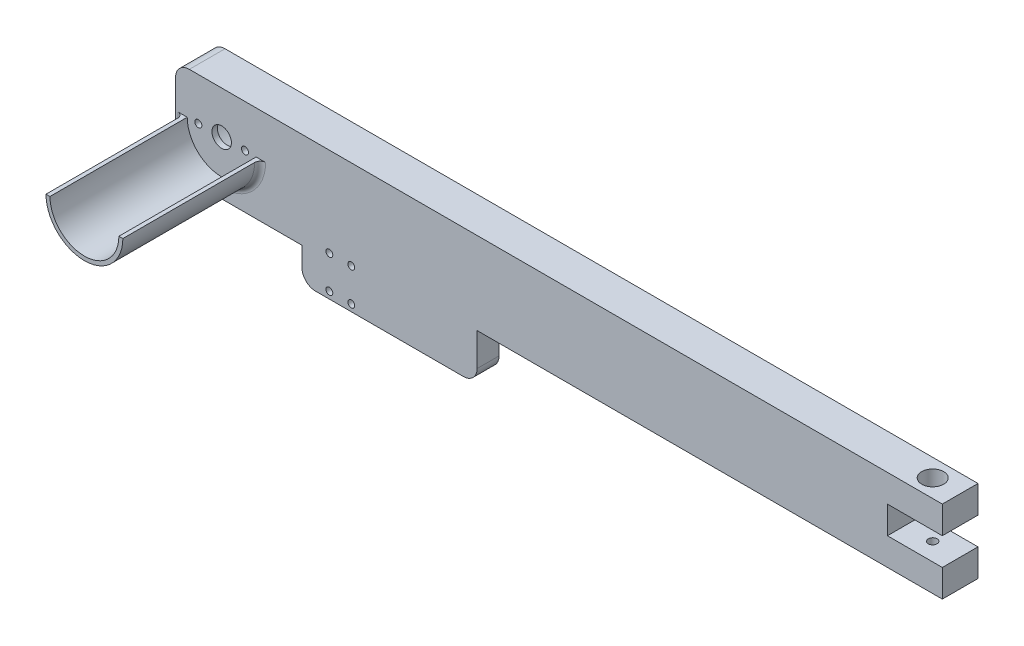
SolidWorks part; units mm, degrees
ref_plane "Front Plane" through (0, 0, 0) normal (0, 0, 1) x (1, 0, 0)
ref_plane "Top Plane" through (0, 0, 0) normal (0, 1, 0) x (1, 0, 0)
ref_plane "Right Plane" through (0, 0, 0) normal (1, 0, 0) x (0, 0, -1)
sketch "Sketch1" plane through (0, 0, 0) normal (0, 0, 1) x (1, 0, 0)
  line L1 (0, 0) -> (355.325, 0)
  line L2 (0, 0) -> (0, 30)
  line L3 (0, 30) -> (355.325, 30)
  line L4 (355.325, 0) -> (355.325, 30)
  line L5 (50, 0) -> (250, 0)
  line L6 (50, 0) -> (50, -17)
  line L7 (50, -17) -> (250, -17)
  line L8 (250, 0) -> (250, -17)
  line L9 (0, 0) -> (355.325, 0)
  line L10 (0, 0) -> (0, -17)
  line L11 (0, -17) -> (355.325, -17)
  line L12 (355.325, 0) -> (355.325, -17)
  line L13 (0, 0) -> (177.6625, 0)
  line L14 (0, 0) -> (0, -17)
  line L15 (0, -17) -> (177.6625, -17)
  line L16 (177.6625, 0) -> (177.6625, -17)
  line L17 (0, 0) -> (50, 0)
  line L18 (0, 0) -> (0, -5)
  line L19 (0, -5) -> (50, -5)
  line L20 (50, 0) -> (50, -5)
  circle A0 centre (20.775, 14.5) radius 12.5
  circle A1 centre (334.55, 14.5) radius 12.5
  circle A2 centre (60, -2.5) radius 1
  circle A3 centre (68, -2.5) radius 1
  circle A4 centre (60, -14.5) radius 1
  circle A5 centre (68, -14.5) radius 1
  dimension "D1" = 25
  dimension "D11" = 2
  dimension "D2" = 313.775
  dimension "D3" = 20.775
  dimension "D4" = 20.775
  dimension "D5" = 30
  dimension "D6" = 15.5
  dimension "D7" = 15.5
  dimension "D8" = 17
  dimension "D9" = 50
  dimension "D10" = 200
  dimension "D12" = 8
  dimension "D13" = 12
  dimension "D14" = 8
  dimension "D15" = 12
  dimension "D16" = 10
  dimension "D17" = 10
  dimension "D18" = 2.5
  dimension "D19" = 2.5
  dimension "D20" = 5
extrude "Boss-Extrude3" add sketch "Sketch1" along normal blind 13 contours L1 L9 L4 L3 L2 A1 A0 | L16 L1 L6 L7 A5 A4 A3 A2 | L10 L19 L6 L1
fillet "Fillet3" radius 5 6 edges at (355.325, 0, 6.5) (355.325, 30, 6.5) (177.6625, -17, 6.5) (50, -17, 6.5) (0, -5, 6.5) (0, 30, 6.5)
sketch "Sketch4" plane through (0, 0, 13) normal (0, 0, 1) x (1, 0, 0)
  line L0 (25.6361, 30) -> (25.6361, 0.3095)
  line L1 (5, 30) -> (350.325, 30) construction
  circle A0 centre (20.775, 14.5) radius 15
  circle A1 centre (20.775, 14.5) radius 12.5
  dimension "D1" = 30
extrude "Boss-Extrude5" add sketch "Sketch4" along normal blind 30 contours L0 A0 M16
fillet "Fillet4" radius 2 1 edges at (5.775, 14.5, 13)
sketch "Sketch5" plane through (0, 0, 0) normal (0, 0, -1) x (-1, 0, 0)
  circle A0 centre (-68, -2.5) radius 1.425
  circle A1 centre (-60, -2.5) radius 1.425
  circle A2 centre (-60, -14.5) radius 1.425
  circle A3 centre (-68, -14.5) radius 1.425
  dimension "D1" = 2.85
extrude "Cut-Extrude1" cut sketch "Sketch5" against normal up to next
sketch "Sketch6" plane through (0, 0, 13) normal (0, 0, 1) x (1, 0, 0)
  line L0 (113.8312, -17) -> (113.8312, 30)
  line L1 (55, -17) -> (172.6625, -17) construction
  line L2 (25.6361, 30) -> (350.325, 30) construction
  circle A0 centre (60, -2.5) radius 1.425
  circle A1 centre (68, -2.5) radius 1.425
  circle A2 centre (68, -14.5) radius 1.425
  circle A3 centre (60, -14.5) radius 1.425
  circle A4 centre (167.6625, -14.5) radius 1.425
  circle A5 centre (159.6625, -14.5) radius 1.425
  circle A6 centre (159.6625, -2.5) radius 1.425
  circle A7 centre (167.6625, -2.5) radius 1.425
extrude "Cut-Extrude2" cut sketch "Sketch6" against normal through all contours A6 | A7 | A4 | A5
sketch "Sketch7" plane through (0, 0, 13) normal (0, 0, 1) x (1, 0, 0)
  line L0 (55, -17) -> (172.6625, -17) construction
  line L1 (113.8312, -17) -> (50, -17)
  line L2 (113.8312, -17) -> (113.8312, -5)
  line L3 (113.8312, -5) -> (50, -5)
  line L4 (50, -17) -> (50, -5)
extrude "Cut-Extrude3" cut sketch "Sketch7" against normal through all
fillet "Fillet5" radius 5 1 edges at (113.8312, -17, 6.5)
sketch "Sketch8" plane through (0, 0, 13) normal (0, 0, 1) x (1, 0, 0)
  line L0 (5, -5) -> (113.8312, -5) construction
  line L1 (52.3855, -5) -> (74.1805, -5)
  line L2 (52.3855, -5) -> (52.3855, 2.0745)
  line L3 (52.3855, 2.0745) -> (74.1805, 2.0745)
  line L4 (74.1805, -5) -> (74.1805, 2.0745)
extrude "Boss-Extrude6" add sketch "Sketch8" against normal blind 10
sketch "Sketch9" plane through (0, 0, 13) normal (0, 0, 1) x (1, 0, 0)
  line L1 (113.8312, -5) -> (32.4684, -5)
  line L2 (113.8312, -5) -> (113.8312, 0)
  line L3 (113.8312, 0) -> (32.4684, 0)
  line L4 (32.4684, -5) -> (32.4684, 0)
extrude "Cut-Extrude4" cut sketch "Sketch9" against normal through all
sketch "Sketch10" plane through (0, 0, 0) normal (0, 0, -1) x (-1, 0, 0)
  line L1 (-177.6625, 0) -> (-113.8312, 0)
  line L2 (-177.6625, 0) -> (-177.6625, -17)
  line L3 (-177.6625, -17) -> (-113.8312, -17)
  line L4 (-113.8312, 0) -> (-113.8312, -17)
extrude "Cut-Extrude5" cut sketch "Sketch10" against normal blind 5
sketch "Sketch12" plane through (0, 0, 13) normal (0, 0, 1) x (1, 0, 0)
  circle A0 centre (159.6625, -2.5) radius 1
  circle A1 centre (167.6625, -2.5) radius 1
  circle A2 centre (167.6625, -14.5) radius 1
  circle A3 centre (159.6625, -14.5) radius 1
  circle A4 centre (159.6625, -14.5) radius 2.2725
  circle A5 centre (167.6625, -14.5) radius 2.3322
  circle A6 centre (167.6625, -2.5) radius 2.5118
  circle A7 centre (159.6625, -2.5) radius 2.5658
  dimension "D1" = 2
extrude "Boss-Extrude7" add sketch "Sketch12" against normal blind 8
sketch "Sketch13" plane through (0, 0, 43) normal (0, 0, 1) x (1, 0, 0)
  line L0 (25.6361, 30) -> (25.6361, -5)
  line L1 (5, -5) -> (32.4684, -5) construction
  circle A0 centre (20.775, 14.5) radius 15
  circle A1 centre (20.775, 14.5) radius 12.5
extrude "Boss-Extrude8" add sketch "Sketch13" along normal blind 30 contours M4 M1 M2 M3
sketch "Sketch14" plane through (0, 0, 13) normal (0, 0, 1) x (1, 0, 0)
  line L0 (0, 0) -> (0, 25) construction
  line L1 (25.6361, 30) -> (350.325, 30) construction
  circle A0 centre (85, 15) radius 13
  circle A1 centre (165, 15) radius 13
  circle A2 centre (245, 15) radius 13
  dimension "D1" = 26
  dimension "D2" = 26
  dimension "D3" = 26
  dimension "D6" = 245
  dimension "D4" = 85
  dimension "D5" = 165
  dimension "D7" = 15
  dimension "D8" = 15
  dimension "D9" = 15
extrude "Cut-Extrude7" cut sketch "Sketch14" against normal through all
sketch "Sketch15" plane through (0, 0, 13) normal (0, 0, 1) x (1, 0, 0)
  circle A0 centre (334.55, 14.5) radius 13.0784
extrude "Boss-Extrude9" add sketch "Sketch15" against normal blind 5.8
sketch "Sketch16" plane through (0, 0, 7.2) normal (0, 0, -1) x (-1, 0, 0)
  circle A0 centre (-334.55, 14.5) radius 2.5
  dimension "D1" = 5
extrude "Cut-Extrude8" cut sketch "Sketch16" against normal blind 27
sketch "Sketch17" plane through (0, 0, 0) normal (-1, 0, 0) x (0, 0, 1)
  line L1 (0, 30) -> (13, 30)
  line L2 (0, 30) -> (0, -5)
  line L3 (0, -5) -> (13, -5)
  line L4 (13, 30) -> (13, -5)
extrude "Cut-Extrude9" cut sketch "Sketch17" against normal blind 4
fillet "Fillet6" radius 5 1 edges at (4, 29.899, 6.5)
fillet "Fillet7" radius 5 1 edges at (4, -4.899, 6.5)
sketch "Sketch18" plane through (355.325, 0, 0) normal (1, 0, 0) x (0, 0, -1)
  line L1 (-13, 30) -> (0, 30)
  line L2 (-13, 30) -> (-13, 0)
  line L3 (-13, 0) -> (0, 0)
  line L4 (0, 30) -> (0, 0)
extrude "Cut-Extrude10" cut sketch "Sketch18" against normal blind 7
fillet "Fillet8" radius 5 2 edges at (348.325, 0, 6.5) (348.325, 30, 6.5)
sketch "Sketch20" plane through (0, 0, 13) normal (0, 0, 1) x (1, 0, 0)
  circle A0 centre (85, 15) radius 12.75
  circle A1 centre (85, 15) radius 13
  circle A2 centre (165, 15) radius 12.75
  circle A3 centre (165, 15) radius 13
  circle A4 centre (245, 15) radius 13
  circle A5 centre (245, 15) radius 12.75
  dimension "D1" = 25.5
  dimension "D2" = 25.5
  dimension "D3" = 25.5
extrude "Boss-Extrude10" add sketch "Sketch20" against normal up to surface (13 mm away)
sketch "Sketch22" plane through (0, 0, 73) normal (0, 0, 1) x (1, 0, 0)
  circle A0 centre (20.775, 14.5) radius 13.25
  dimension "D1" = 26.5
extrude "Cut-Extrude11" cut sketch "Sketch22" against normal through all
sketch "Sketch24" plane through (0, 0, 13) normal (0, 0, 1) x (1, 0, 0)
  circle A0 centre (334.55, 14.5) radius 2.75
  dimension "D1" = 5.5
extrude "Cut-Extrude12" cut sketch "Sketch24" against normal through all
sketch "Sketch26" plane through (0, 0, 13) normal (0, 0, 1) x (1, 0, 0)
  line L0 (113.8312, 0) -> (32.4684, 0) construction
  line L1 (50.005, 0) -> (113.835, 0)
  line L2 (50.005, 0) -> (50.005, -17)
  line L3 (50.005, -17) -> (113.835, -17)
  line L4 (113.835, 0) -> (113.835, -17)
  line L5 (9, -5) -> (32.4684, -5) construction
  line L6 (32.4684, 0) -> (50.005, 0)
  line L7 (32.4684, 0) -> (32.4684, -5)
  line L8 (32.4684, -5) -> (50.005, -5)
  line L9 (50.005, 0) -> (50.005, -5)
  arc A0 (25.6361, 2.1739) -> (25.6361, 26.8261) centre (20.775, 14.5) ccw construction
  circle A1 centre (60.005, -2.5) radius 1.25
  circle A2 centre (68.005, -2.5) radius 1.25
  circle A3 centre (68.005, -14.5) radius 1.25
  circle A4 centre (60.005, -14.5) radius 1.25
  dimension "D1" = 29.23
  dimension "D4" = 2.5
  dimension "D10" = 10
  dimension "D2" = 63.83
  dimension "D3" = 17
  dimension "D5" = 8
  dimension "D6" = 12
  dimension "D7" = 2.5
  dimension "D8" = 8
  dimension "D9" = 12
  dimension "D11" = 10
  dimension "D12" = 2.5
extrude "Boss-Extrude11" add sketch "Sketch26" against normal up to surface (13 mm away) contours L4 L2 L3 A4 A3 A2 A1 M13 M12 M11 | L8 L2 M10 M11
fillet "Fillet9" radius 5 2 edges at (50.005, -17, 6.5) (113.835, -17, 6.5)
sketch "Sketch28" plane through (0, 0, 5) normal (0, 0, -1) x (-1, 0, 0)
  line L1 (-177.6625, 0) -> (-113.8312, 0)
  line L2 (-177.6625, 0) -> (-177.6625, -17.3361)
  line L3 (-177.6625, -17.3361) -> (-113.8312, -17.3361)
  line L4 (-113.8312, 0) -> (-113.8312, -17.3361)
extrude "Cut-Extrude14" cut sketch "Sketch28" against normal through all
sketch "Sketch30" plane through (0, 0, 0) normal (0, 0, -1) x (-1, 0, 0)
  circle A0 centre (-334.55, 14.5) radius 13.25
  dimension "D1" = 26.5
extrude "Cut-Extrude18" cut sketch "Sketch30" against normal up to surface (7.2 mm away)
sketch "Sketch31" plane through (0, 0, 7.2) normal (0, 0, -1) x (-1, 0, 0)
  circle A0 centre (-334.55, 14.5) radius 3
  dimension "D1" = 6
extrude "Cut-Extrude19" cut sketch "Sketch31" against normal through all
sketch "Sketch32" plane through (0, 0, 0) normal (0, 0, -1) x (-1, 0, 0)
  line L0 (-283.325, 30) -> (-283.325, 20)
  line L1 (-9, 30) -> (-343.325, 30) construction
  line L2 (-283.325, 20) -> (-263.325, 20)
  line L3 (-263.325, 20) -> (-263.325, 10)
  line L4 (-263.325, 10) -> (-283.325, 10)
  line L5 (-283.325, 10) -> (-283.325, 0)
  line L6 (-113.8312, 0) -> (-343.325, 0) construction
  line L7 (-348.325, 5) -> (-348.325, 25) construction
  line L14 (-108.8313, -17) -> (-55.005, -17)
  line L18 (-50.005, -5) -> (-9, -5)
  line L19 (-4, 0) -> (-4, 25)
  line L20 (-9, 30) -> (-343.325, 30)
  line L21 (-348.325, 25) -> (-348.325, 5)
  line L22 (-343.325, 0) -> (-113.8312, 0)
  line L26 (-50.005, -5) -> (-9, -5)
  line L27 (-4, 0) -> (-4, 25)
  line L28 (-9, 30) -> (-343.325, 30)
  line L29 (-348.325, 25) -> (-348.325, 5)
  line L30 (-343.325, 0) -> (-113.8312, 0)
  line L34 (-108.8313, -17) -> (-55.005, -17)
  line L36 (-50.005, -12) -> (-50.005, -5)
  line L37 (-50.005, -12) -> (-50.005, -5)
  line L38 (-113.8312, 0) -> (-113.8312, -12)
  line L39 (-113.8312, 0) -> (-113.8312, -12)
  arc A6 (-55.005, -17) -> (-50.005, -12) centre (-55.005, -12) ccw
  arc A7 (-9, -5) -> (-4, 0) centre (-9, 0) ccw
  arc A8 (-4, 25) -> (-9, 30) centre (-9, 25) ccw
  arc A9 (-343.325, 30) -> (-348.325, 25) centre (-343.325, 25) ccw
  arc A10 (-348.325, 5) -> (-343.325, 0) centre (-343.325, 5) ccw
  arc A13 (-9, -5) -> (-4, 0) centre (-9, 0) ccw
  arc A14 (-4, 25) -> (-9, 30) centre (-9, 25) ccw
  arc A15 (-343.325, 30) -> (-348.325, 25) centre (-343.325, 25) ccw
  arc A16 (-348.325, 5) -> (-343.325, 0) centre (-343.325, 5) ccw
  arc A18 (-55.005, -17) -> (-50.005, -12) centre (-55.005, -12) ccw
  arc A20 (-113.8312, -12) -> (-108.8313, -17) centre (-108.8313, -12) ccw
  arc A21 (-113.8312, -12) -> (-108.8313, -17) centre (-108.8313, -12) ccw
  dimension "D1" = 65
  dimension "D2" = 20
  dimension "D3" = 10
  dimension "D4" = 10
  dimension "D5" = 65
  dimension "D6" = 0
extrude "Cut-Extrude21" cut sketch "Sketch32" against normal through all contours L5 L4 L3 L2 L0 M16 M17 M18 M19 M20 M4 | M4
sketch "Sketch33" plane through (0, 30, 0) normal (0, 1, 0) x (1, 0, 0)
  line L0 (9, 0) -> (283.325, 0) construction
  line L1 (283.325, -13) -> (283.325, 0) construction
  circle A0 centre (273.325, -6.5) radius 1.6
  dimension "D1" = 3.2
  dimension "D2" = 6.5
  dimension "D3" = 10
extrude "Cut-Extrude22" cut sketch "Sketch33" against normal through all
sketch "Sketch34" plane through (0, 30, 0) normal (0, 1, 0) x (1, 0, 0)
  circle A1 centre (273.325, -6.5) radius 4
  dimension "D1" = 8
extrude "Cut-Extrude23" cut sketch "Sketch34" against normal blind 7.5
sketch "Sketch35" plane through (0, 0, 0) normal (0, -1, 0) x (1, 0, 0)
  circle A0 centre (273.325, 6.5) radius 4
  dimension "D1" = 8
extrude "Cut-Extrude24" cut sketch "Sketch35" against normal blind 7.5
sketch "Sketch36" plane through (0, 0, 0) normal (0, 0, -1) x (-1, 0, 0)
  line L1 (-113.8312, 0) -> (2.3065, 0)
  line L2 (-113.8312, 0) -> (-113.8312, -19.8063)
  line L3 (-113.8312, -19.8063) -> (2.3065, -19.8063)
  line L4 (2.3065, 0) -> (2.3065, -19.8063)
extrude "Cut-Extrude26" cut sketch "Sketch36" against normal blind 5
sketch "Sketch40" plane through (0, 0, 73) normal (0, 0, 1) x (1, 0, 0)
  line L1 (1.1291, -7.5125) -> (31.1312, -7.5125)
  line L2 (1.1291, -7.5125) -> (1.1291, 32.3958)
  line L3 (1.1291, 32.3958) -> (31.1312, 32.3958)
  line L4 (31.1312, -7.5125) -> (31.1312, 32.3958)
extrude "Cut-Extrude27" cut sketch "Sketch40" against normal up to surface (60 mm away)
sketch "Sketch41" plane through (0, 0, 13) normal (0, 0, 1) x (1, 0, 0)
  line L0 (8.225, 14.5) -> (6.775, 14.5)
  line L1 (33.325, 14.5) -> (34.775, 14.5)
  circle A0 centre (20.775, 14.5) radius 12.55
  circle A1 centre (20.775, 14.5) radius 14
  dimension "D1" = 25.1
  dimension "D2" = 28
extrude "Boss-Extrude13" add sketch "Sketch41" along normal blind 50 contours A0 L0 L1 M1 | L0 A1 L1 M1
fillet "Fillet10" radius 2 1 edges at (20.775, 0.5, 13)
fillet "Fillet11" radius 2 1 edges at (20.775, 1.25, 13)
sketch "Sketch43" plane through (0, 0, 13) normal (0, 0, 1) x (1, 0, 0)
  circle A0 centre (20.775, 14.5) radius 13.25
extrude "Boss-Extrude15" add sketch "Sketch43" against normal blind 2
sketch "Sketch45" plane through (0, 0, 11) normal (0, 0, -1) x (-1, 0, 0)
  line L0 (-29.275, 14.5) -> (-12.275, 14.5) construction
  circle A0 centre (-12.275, 14.5) radius 1.275
  circle A1 centre (-29.275, 14.5) radius 1.275
  circle A2 centre (-20.775, 14.5) radius 13.25 construction
  circle A3 centre (-20.775, 14.5) radius 3.55
  dimension "D1" = 2.55
  dimension "D2" = 2.55
  dimension "D5" = 7.1
  dimension "D3" = 8.5
  dimension "D4" = 8.5
extrude "Cut-Extrude28" cut sketch "Sketch45" against normal blind 3
sketch "Sketch46" plane through (0, 0, 13) normal (0, 0, 1) x (1, 0, 0)
  circle A0 centre (85, 15) radius 12.75
  circle A1 centre (165, 15) radius 12.75
  circle A2 centre (245, 15) radius 12.75
extrude "Boss-Extrude16" add sketch "Sketch46" against normal blind 4.9
